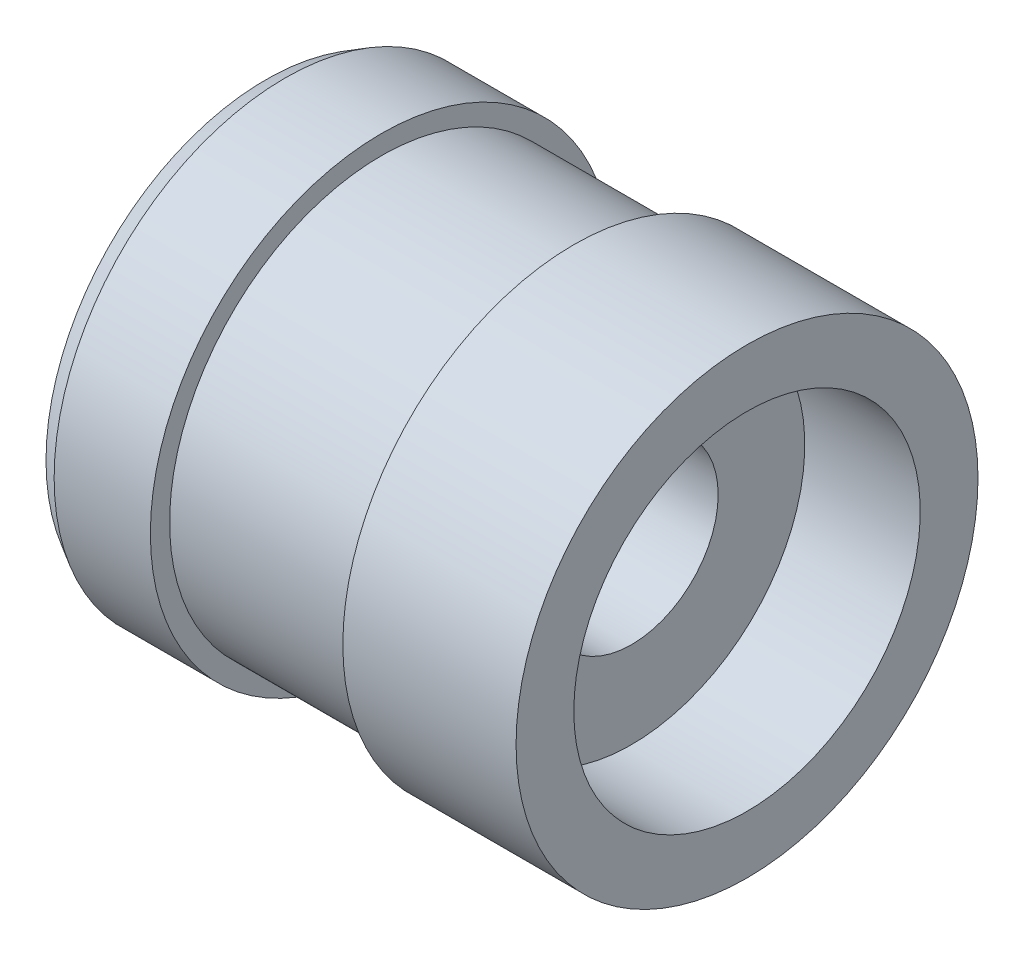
SolidWorks part; units mm, degrees
ref_plane "Plan de face" through (0, 0, 0) normal (0, 0, 1) x (1, 0, 0)
ref_plane "Plan de dessus" through (0, 0, 0) normal (0, 1, 0) x (1, 0, 0)
ref_plane "Plan de droite" through (0, 0, 0) normal (1, 0, 0) x (0, 0, -1)
sketch "Esquisse1" plane through (0, 0, 0) normal (0, 0, 1) x (1, 0, 0)
  line L0 (0, 6) -> (0, 0)
  line L1 (0, 0) -> (12.5, 0)
  line L2 (12.5, 0) -> (12.5, 6)
  line L3 (12.5, 6) -> (8, 6)
  line L4 (8, 6) -> (8, 5.5)
  line L5 (8, 5.5) -> (3, 5.5)
  line L6 (3, 5.5) -> (3, 6)
  line L7 (3, 6) -> (0, 6)
  line L8 (0, 0) -> (12.5, 0) construction
revolve "Révolution1" add sketch "Esquisse1" angle 360 about L8
ref_plane "Plan4" through (0, 0, 0) normal (0, 0, -1) x (-1, 0, 0)
sketch "Esquisse2" plane through (0, 0, 0) normal (0, 0, -1) x (-1, 0, 0)
  line L0 (-12.5, 4.5) -> (-12.5, 0)
  line L1 (-12.5, 0) -> (0, 0)
  line L2 (0, 0) -> (0, 0.75)
  line L3 (0, 0.75) -> (-1.5, 0.75)
  line L4 (-1.5, 0.75) -> (-1.5, 2)
  line L5 (-1.5, 2) -> (-6.5, 2)
  line L6 (-6.5, 2) -> (-6.5, 2.25)
  line L7 (-6.5, 2.25) -> (-9.5, 2.25)
  line L8 (-9.5, 2.25) -> (-9.5, 4.5)
  line L9 (-9.5, 4.5) -> (-12.5, 4.5)
  line L10 (-12.5, 0) -> (0, 0) construction
revolve "Enlèvement de matière-Révolution1" cut sketch "Esquisse2" angle 360 about L10
hole_wizard "Perçage1" positions "Esquisse3D1" profile "Esquisse3" legacy
sketch3d "Esquisse3D1"
  point P0 (5.5, 0, -5.5)
sketch "Esquisse3" plane through (5.5, 0, -5.5) normal (1, 0, 0) x (0, 1, 0)
  line L0 (0, 0) -> (0, 3.5)
  line L1 (0, 3.5) -> (0.75, 3.5)
  line L2 (0.75, 3.5) -> (0.75, 2)
  line L3 (0.75, 2) -> (1.5, 2)
  line L4 (1.5, 2) -> (1.5, 0)
  line L5 (1.5, 0) -> (0, 0)
  line L6 (0, 110) -> (0, -10) construction
  dimension "Diamètre" = 1.5
  dimension "Profondeur" = 3.5
  dimension "Diamètre chambrage" = 3
  dimension "Profondeur chambrage" = 2
hole_wizard "Perçage2" positions "Esquisse3D2" profile "Esquisse4" legacy
sketch3d "Esquisse3D2"
  point P0 (5.5, -5.5, 0)
sketch "Esquisse4" plane through (5.5, -5.5, 0) normal (1, 0, 0) x (0, 0, -1)
  line L0 (0, 0) -> (0, 3.5)
  line L1 (0, 3.5) -> (0.75, 3.5)
  line L2 (0.75, 3.5) -> (0.75, 2)
  line L3 (0.75, 2) -> (1.5, 2)
  line L4 (1.5, 2) -> (1.5, 0)
  line L5 (1.5, 0) -> (0, 0)
  line L6 (0, 110) -> (0, -10) construction
  dimension "Diamètre" = 1.5
  dimension "Profondeur" = 3.5
  dimension "Diamètre chambrage" = 3
  dimension "Profondeur chambrage" = 2
hole_wizard "Perçage3" positions "Esquisse3D3" profile "Esquisse5" legacy
sketch3d "Esquisse3D3"
  point P0 (5.5, 5.5, 0)
sketch "Esquisse5" plane through (5.5, 5.5, 0) normal (1, 0, 0) x (0, 0, 1)
  line L0 (0, 0) -> (0, 11.5)
  line L1 (0, 11.5) -> (0.75, 11.5)
  line L2 (0.75, 11.5) -> (0.75, 2)
  line L3 (0.75, 2) -> (1.5, 2)
  line L4 (1.5, 2) -> (1.5, 0)
  line L5 (1.5, 0) -> (0, 0)
  line L6 (0, 110) -> (0, -10) construction
  dimension "Diamètre" = 1.5
  dimension "Profondeur" = 11.5
  dimension "Diamètre chambrage" = 3
  dimension "Profondeur chambrage" = 2
hole_wizard "Perçage4" positions "Esquisse3D4" profile "Esquisse6" legacy
sketch3d "Esquisse3D4"
  point P0 (5.5, 0, 5.5)
sketch "Esquisse6" plane through (5.5, 0, 5.5) normal (1, 0, 0) x (0, -1, 0)
  line L0 (0, 0) -> (0, 11.5)
  line L1 (0, 11.5) -> (0.75, 11.5)
  line L2 (0.75, 11.5) -> (0.75, 2)
  line L3 (0.75, 2) -> (1.5, 2)
  line L4 (1.5, 2) -> (1.5, 0)
  line L5 (1.5, 0) -> (0, 0)
  line L6 (0, 110) -> (0, -10) construction
  dimension "Diamètre" = 1.5
  dimension "Profondeur" = 11.5
  dimension "Diamètre chambrage" = 3
  dimension "Profondeur chambrage" = 2
chamfer "Chanfrein1" distance 0.5 angle 30 1 edges at (0, 0, -6)
